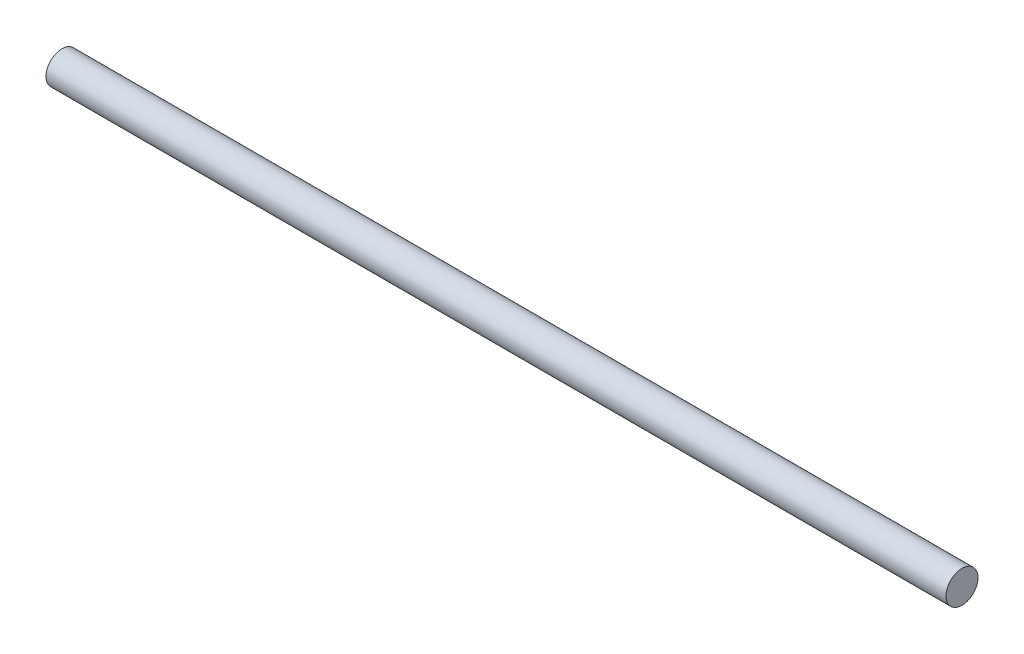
SolidWorks part; units mm, degrees
ref_plane "Front Plane" through (0, 0, 0) normal (0, 0, 1) x (1, 0, 0)
ref_plane "Top Plane" through (0, 0, 0) normal (0, 1, 0) x (1, 0, 0)
ref_plane "Right Plane" through (0, 0, 0) normal (1, 0, 0) x (0, 0, -1)
sketch "Sketch1" plane through (0, 0, 0) normal (1, 0, 0) x (0, 0, -1)
  circle A0 centre (0, -6.3714) radius 4
  dimension "D1" = 8
extrude "Boss-Extrude1" add sketch "Sketch1" along normal blind 225
